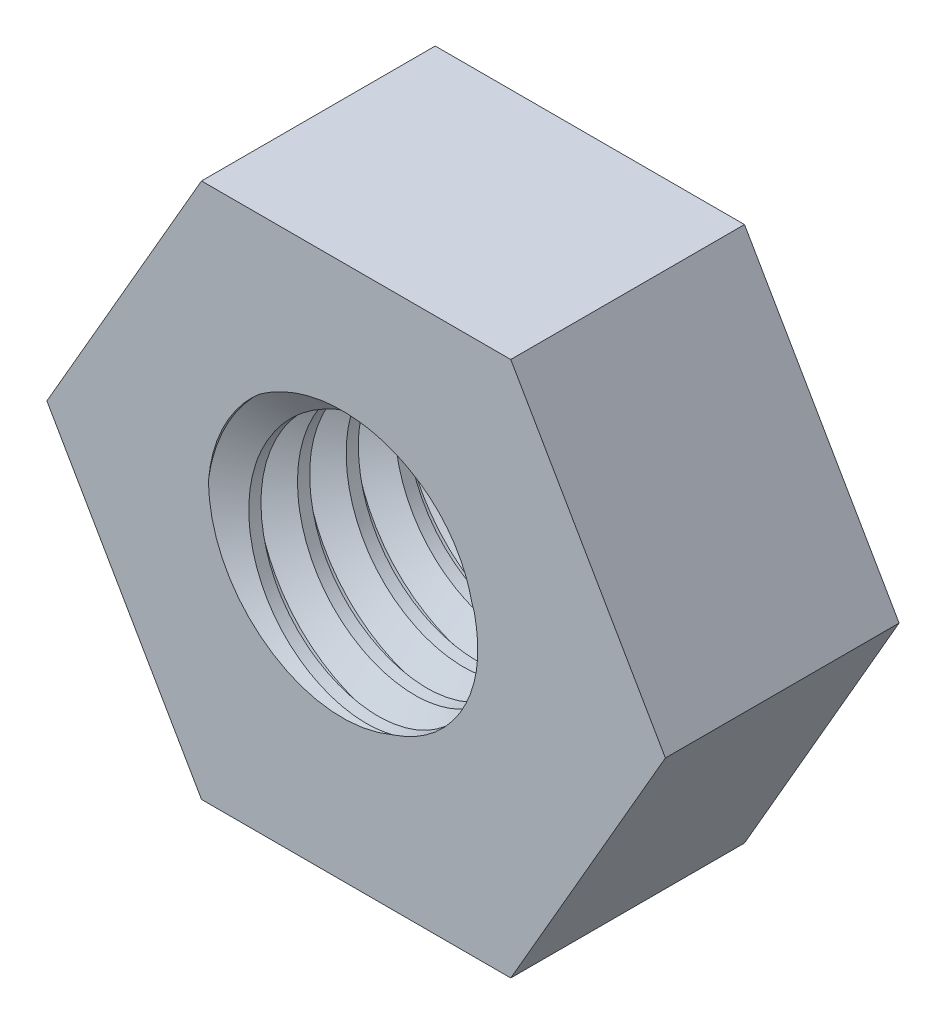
SolidWorks part; units mm, degrees
ref_plane "Front Plane" through (0, 0, 0) normal (0, 0, 1) x (1, 0, 0)
ref_plane "Top Plane" through (0, 0, 0) normal (0, 1, 0) x (1, 0, 0)
ref_plane "Right Plane" through (0, 0, 0) normal (1, 0, 0) x (0, 0, -1)
sketch "Sketch1" plane through (0, 0, 0) normal (0, 0, 1) x (1, 0, 0)
  line L1 (3.1754, 0) -> (1.5877, 2.75)
  line L2 (1.5877, 2.75) -> (-1.5877, 2.75)
  line L3 (-1.5877, 2.75) -> (-3.1754, 0)
  line L4 (-3.1754, 0) -> (-1.5877, -2.75)
  line L5 (-1.5877, -2.75) -> (1.5877, -2.75)
  line L6 (1.5877, -2.75) -> (3.1754, 0)
  circle A0 centre (0, 0) radius 2.75 construction
  dimension "D1" = 5.5
extrude "Boss-Extrude1" add sketch "Sketch1" against normal blind 2.4
sketch "Sketch2" plane through (0, 0, 0) normal (0, 0, 1) x (1, 0, 0)
  circle A0 centre (0, 0) radius 1.25
  dimension "D1" = 2.5
extrude "Cut-Extrude1" cut sketch "Sketch2" along normal through all and the other way through all
thread "Thread_M3x0.5_Internal_Through_RH" pitch 0.5 start angle 0, offset 0, length 0, pitch 0.5, diameter 2.5
ref_plane "Plane1" through (1.25, 0, -2.4) normal (0, -1, 0) x (1, 0, 0)
sketch "Thread Profile1" plane through (1.25, 0, -2.4) normal (0, -1, 0) x (1, 0, 0)
  line L0 (0, 0) -> (0, 0.5) construction
  line L1 (0, 0) -> (0.2706, 0.1562)
  line L2 (0.2706, 0.1562) -> (0.2706, 0.2187)
  line L3 (0.2706, 0.2187) -> (0, 0.375)
  line L4 (0.2706, 0.1875) -> (0, 0.1875) construction
  line L11 (0, 0) -> (0, 0.375)
  point P2 (0, 0)
  dimension "Pitch" = 0.5
  dimension "Profile_Angle" = 60
  dimension "Profile_Land" = 0.0625
  dimension "Profile_Height" = 0.2706
